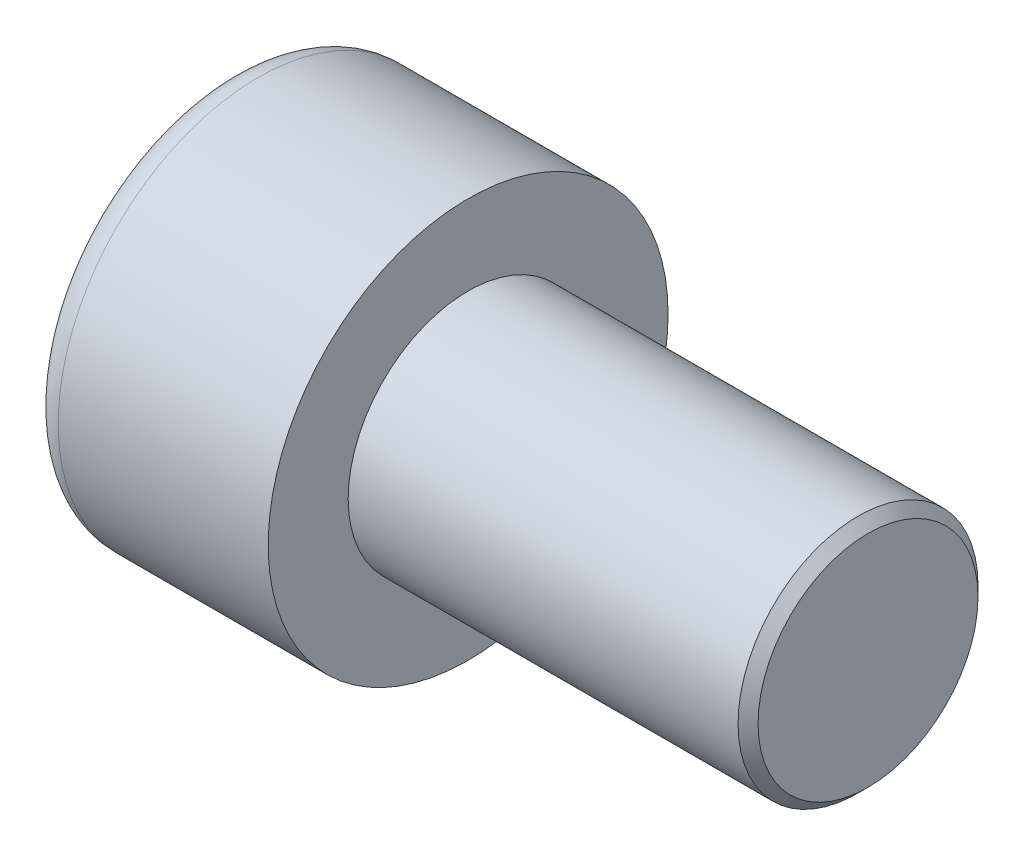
SolidWorks part; units mm, degrees
ref_plane "Front" through (0, 0, 0) normal (0, 0, 1) x (1, 0, 0)
ref_plane "Top" through (0, 0, 0) normal (0, 1, 0) x (1, 0, 0)
ref_plane "Right" through (0, 0, 0) normal (1, 0, 0) x (0, 0, -1)
sketch "Sketch1" plane through (0, 0, 0) normal (1, 0, 0) x (0, 0, -1)
  circle A0 centre (0, 0) radius 5
  dimension "dk" = 10
extrude "BaseHead" add sketch "Sketch1" along normal blind 6
sketch "Sketch2" plane through (6, 0, 0) normal (1, 0, 0) x (0, 0, -1)
  circle A0 centre (0, 0) radius 3
  dimension "d" = 6
extrude "BaseBody" add sketch "Sketch2" along normal blind 10
sketch "Sketch3" plane through (0, 0, 0) normal (1, 0, 0) x (0, 0, -1)
  line L1 (2.8868, 0) -> (1.4434, 2.5)
  line L2 (1.4434, 2.5) -> (-1.4434, 2.5)
  line L3 (-1.4434, 2.5) -> (-2.8868, 0)
  line L4 (-2.8868, 0) -> (-1.4434, -2.5)
  line L5 (-1.4434, -2.5) -> (1.4434, -2.5)
  line L6 (1.4434, -2.5) -> (2.8868, 0)
  circle A0 centre (0, 0) radius 2.5 construction
  dimension "s" = 5
  dimension "e" = 5.7735
extrude "HexagonSocket" cut sketch "Sketch3" along normal blind 3
sketch "Sketch4" plane through (-4.1961, 0.75, 0) normal (0, 0, 1) x (-1, 0, 0)
  line L0 (-7.1961, 3.25) -> (-8.6395, 0.75)
  line L2 (-8.6395, 0.75) -> (-7.1961, 0.75)
  line L3 (-7.1961, 0.75) -> (-7.1961, 3.25)
  line L4 (-5.0351, 0.75) -> (0.839, 0.75) construction
  line L5 (-20.1961, 0.75) -> (-10.1961, 0.75) construction
  line L6 (-10.1961, 0.75) -> (-4.1961, 0.75) construction
  dimension "m" = 60
revolve "Cut-Revolve1" cut sketch "Sketch4" angle 360 about L4
fillet "HeadFillet" [suppressed] radius 0.25
fillet "TopFillet" radius 0.75 1 edges at (0, 0, -5)
chamfer "Chamfer1" distance 0.25 angle 45 1 edges at (16, 0, -3)
sketch "Sketch5" plane through (0, 0, 0) normal (0, 0, 1) x (1, 0, 0)
  line L0 (15.75, 2.531) -> (16.0207, 3)
  line L1 (16.0207, 3) -> (16.0207, 3.5415)
  line L2 (16.0207, 3.5415) -> (15.4793, 3.5415)
  line L3 (15.4793, 3.5415) -> (15.4793, 3)
  line L4 (15.4793, 3) -> (15.75, 2.531)
  line L5 (0, 0) -> (7.8886, 0) construction
  line L6 (15.75, -3) -> (15.75, 3) construction
  dimension "D1" = 6
  dimension "D2" = 0.5415
revolve "Cut-Revolve10" [suppressed] cut sketch "Sketch5" angle 360 about L5
pattern_linear "LPattern10" [suppressed] count 15 spacing 0.6498 along (1, 0, 0)
equation "\"r1@TopFillet\" = \"d@Sketch2\" / 8"
equation "\"D1@Chamfer1\" = \"r@HeadFillet\""
equation "\"D1@Sketch5\" = \"d@Sketch2\""
equation "\"D2@Sketch5\" =  ( \"d@Sketch2\" - \"D2@ThreadCosmetic1\" )  / 2"
equation "\"D3@LPattern10\" = \"D2@Sketch5\" * 1.2"
equation "\"D1@LPattern10\" = \"b@ThreadCosmetic1\" / \"D3@LPattern10\""
